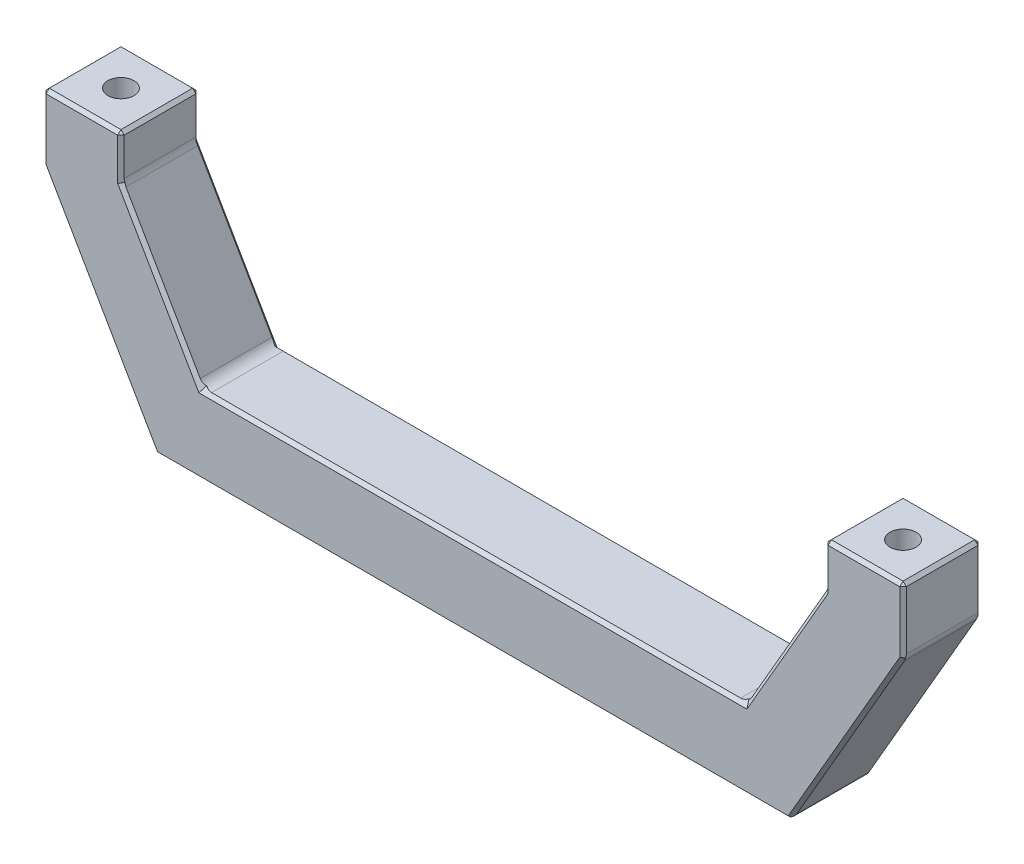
SolidWorks part; units mm, degrees
ref_plane "Ebene vorne" through (0, 0, 0) normal (0, 0, 1) x (1, 0, 0)
ref_plane "Ebene oben" through (0, 0, 0) normal (0, 1, 0) x (1, 0, 0)
ref_plane "Ebene rechts" through (0, 0, 0) normal (1, 0, 0) x (0, 0, -1)
sketch "Skizze1" plane through (0, 0, 0) normal (0, 0, 1) x (1, 0, 0)
  line L0 (-66, 40) -> (-66, 30)
  line L1 (-66, 30) -> (-48.6795, 0)
  line L2 (-48.6795, 0) -> (48.6795, 0)
  line L3 (48.6795, 0) -> (66, 30)
  line L4 (66, 30) -> (66, 40)
  line L5 (66, 40) -> (54, 40)
  line L6 (54, 40) -> (54, 33.2154)
  line L7 (54, 33.2154) -> (41.7513, 12)
  line L8 (41.7513, 12) -> (-41.7513, 12)
  line L9 (-41.7513, 12) -> (-54, 33.2154)
  line L10 (-54, 33.2154) -> (-54, 40)
  line L11 (-54, 40) -> (-66, 40)
  point P18 (0, 0)
  point P19 (-60, 40)
  point P20 (60, 40)
  dimension "D1" = 12
  dimension "D2" = 12
  dimension "D3" = 10
  dimension "D4" = 60
  dimension "D5" = 60
  dimension "D6" = 12
  dimension "D7" = 40
  dimension "D8" = 120
extrude "Aufsatz-Linear austragen1" add sketch "Skizze1" along normal mid plane 12
chamfer "Fase1" distance 0.5 angle 45 28 edges at (-54, 36.6077, 6) (-47.8756, 22.6077, 6) (0, 12, 6) (47.8756, 22.6077, 6) (54, 36.6077, 6) (60, 40, 6) (66, 35, 6) (57.3397, 15, 6) (0, 0, 6) (-57.3397, 15, 6) (-66, 35, 6) (-60, 40, 6) (-66, 35, -6) (-57.3397, 15, -6) (0, 0, -6) (57.3397, 15, -6) (66, 35, -6) (66, 40, 0) (60, 40, -6) (-66, 40, 0) (-60, 40, -6) (-54, 40, 0) (-54, 36.6077, -6) (-47.8756, 22.6077, -6) (0, 12, -6) (47.8756, 22.6077, -6) (54, 36.6077, -6) (54, 40, 0)
fillet "Verrundung1" radius 2 8 edges at (-66, 30, 0) (-48.6795, 0, 0) (48.6795, 0, 0) (66, 30, 0) (54, 33.2154, 0) (41.7513, 12, 0) (-41.7513, 12, 0) (-54, 33.2154, 0)
sketch "Skizze2" plane through (0, 40, 0) normal (0, 1, 0) x (1, 0, 0)
  circle A0 centre (-60, 0) radius 2
  circle A1 centre (60, 0) radius 2
  dimension "D3" = 4
  dimension "D1" = 60
  dimension "D2" = 60
extrude "Schnitt-Linear austragen1" cut sketch "Skizze2" against normal blind 7
